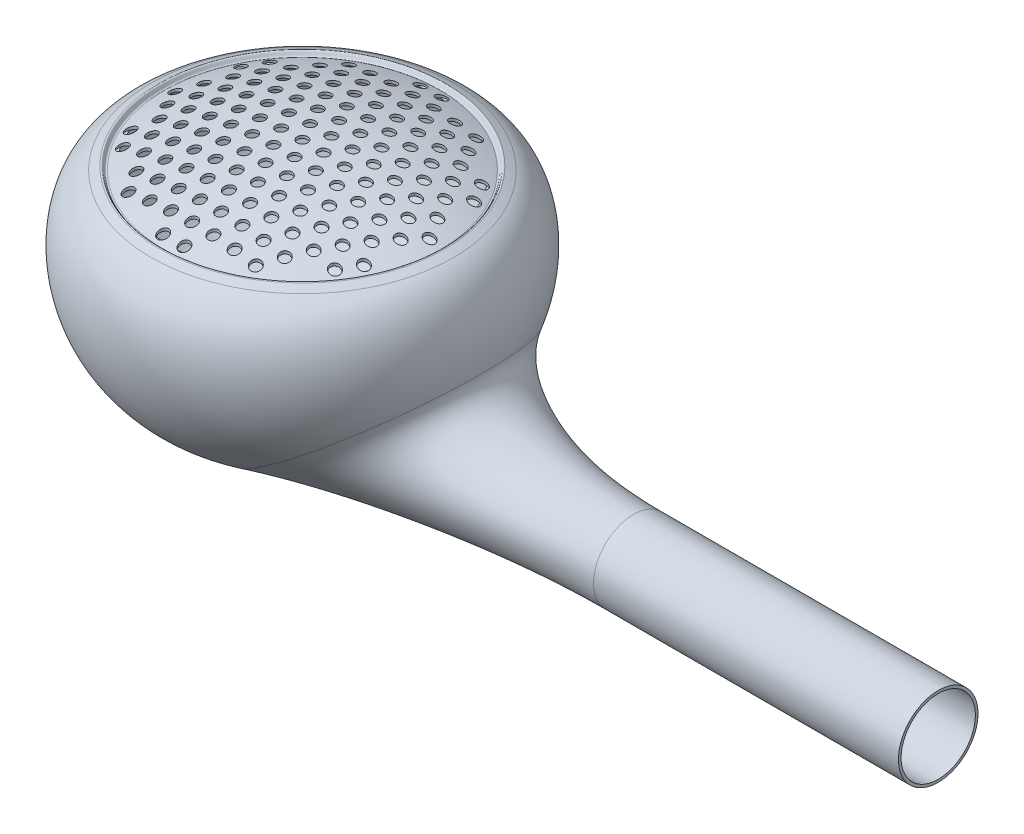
SolidWorks part; units mm, degrees
ref_plane "Front Plane" through (0, 0, 0) normal (0, 0, 1) x (1, 0, 0)
ref_plane "Top Plane" through (0, 0, 0) normal (0, 1, 0) x (1, 0, 0)
ref_plane "Right Plane" through (0, 0, 0) normal (1, 0, 0) x (0, 0, -1)
sketch "Sketch1" plane through (0, 0, 0) normal (0, 0, 1) x (1, 0, 0)
  line L0 (0, 12) -> (0, -80) construction
  line L1 (35.8265, -80) -> (-35.8265, -80) construction
  line L2 (-20.3615, 12) -> (20.3615, 12) construction
  line L3 (-123.4209, -32.3956) -> (9.4209, 32.3956) construction
  spline S0 degree 3 poles (0, 12) (-20.3333, 12) (-40.239, 8.1749) (-57, 0) knots 0 0 0 0 1 1 1 1
  spline S1 degree 3 poles (-57, 0) (-79.1703, -10.8132) (-73.3333, -80) (0, -80) knots 0 0 0 0 1 1 1 1
  dimension "D3" = 61
  dimension "D4" = 220
  dimension "D6" = 74
  dimension "D1" = 92
  dimension "D2" = 12
  dimension "D5" = 57
  dimension "D7" = 64
surface "Surface-Revolve1" sketch "Sketch1" parameters "D1"=360
sketch "Sketch2" plane through (0, 0, 0) normal (0, 0, 1) x (1, 0, 0)
  line L0 (0, -80) -> (82.7, -22.1)
  dimension "D1" = 82.7
  dimension "D2" = 57.9
surface "Surface-Trim1"
surface "Surface-Offset1" parameters "D1"=2
sketch "Sketch3" plane through (0, 0, 0) normal (0, 0, 1) x (1, 0, 0)
  line L0 (0, -80) -> (230, -80) construction
  line L1 (92.3242, -65) -> (217.8234, -65) construction
  line L2 (124.8744, -50) -> (239.8744, -50)
  dimension "D1" = 230
  dimension "D2" = 115
  dimension "D3" = 15
  dimension "D4" = 15
surface "Surface-Revolve2" sketch "Sketch3" parameters "D1"=360
other "Boundary-Surface1"
sketch "Sketch4" plane through (0, 0, 0) normal (0, 1, 0) x (1, 0, 0)
  circle A0 centre (0, 0) radius 54
  dimension "D1" = 108
surface "Surface-Trim2"
sketch "Sketch5" plane through (0, 0, 0) normal (0, 1, 0) x (1, 0, 0)
  circle A0 centre (0, 0) radius 52
  dimension "D1" = 104
surface "Surface-Trim3"
other "Boundary-Surface2"
sketch "Sketch6" plane through (0, 0, 0) normal (0, 1, 0) x (1, 0, 0)
  line L0 (0, 0) -> (-52, 0) construction
  circle A0 centre (0, 0) radius 52 construction
  circle A1 centre (0, 0) radius 52
surface "Surface-Knit1"
thicken "Thicken1" surfaces to thicken 109 thickness 1 parameters "D1"=1
other "Fill Pattern1" parameters "D10"=4, "D1"=8, "D2"=60, "D3"=1
